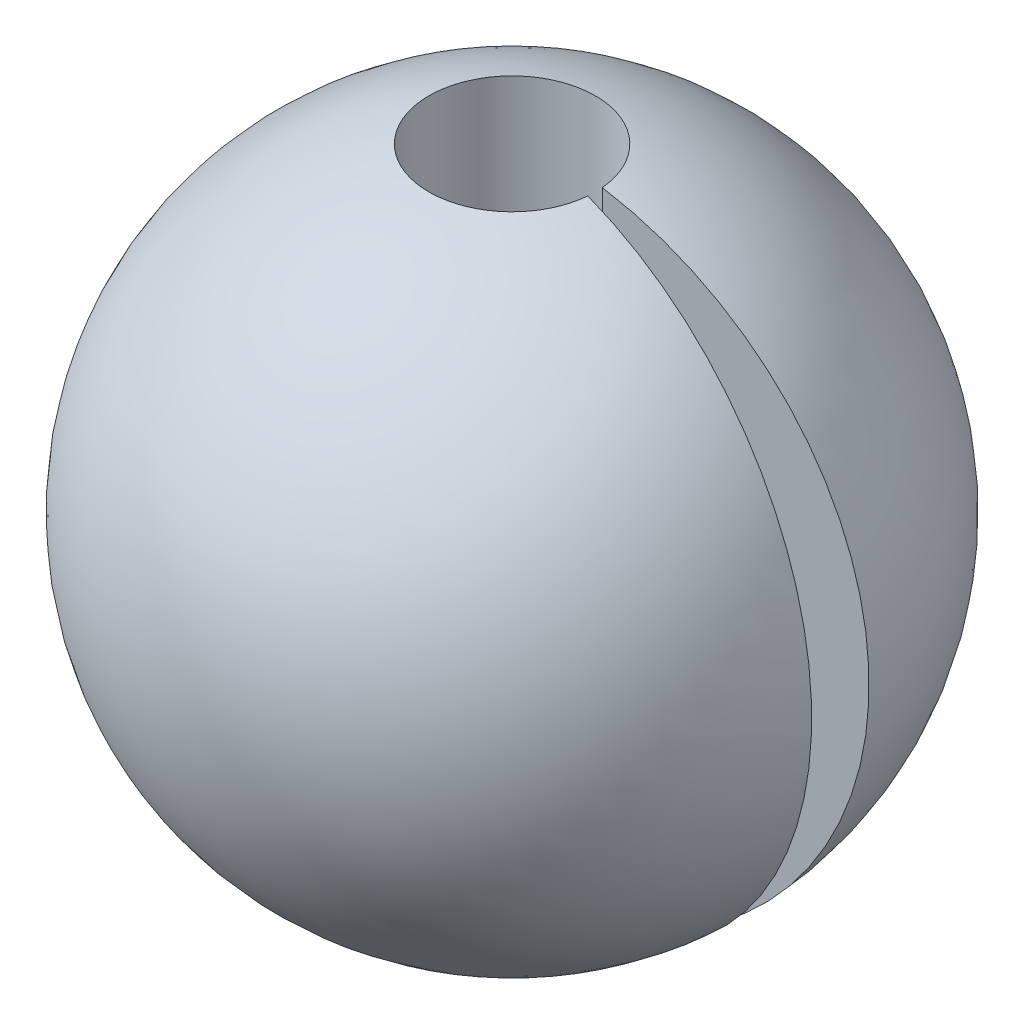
SolidWorks part; units mm, degrees
ref_plane "前视基准面" through (0, 0, 0) normal (0, 0, 1) x (1, 0, 0)
ref_plane "上视基准面" through (0, 0, 0) normal (0, 1, 0) x (1, 0, 0)
ref_plane "右视基准面" through (0, 0, 0) normal (1, 0, 0) x (0, 0, -1)
sketch "草图2" plane through (0, 0, 0) normal (1, 0, 0) x (0, 0, -1)
  line L0 (0, 0) -> (0, 203460.7422) construction
  line L2 (-240, 1071.1844) -> (-240, -767.1844)
  arc A0 (-240, 1071.1844) -> (-240, -767.1844) centre (0, 152) ccw
  dimension "D2" = 1900
revolve "旋转1" add sketch "草图2" angle 360 about L0
sketch "草图3" plane through (0, 0, 0) normal (0, 1, 0) x (1, 0, 0)
  line L0 (0, 0) -> (50000, 0) construction
  line L1 (12.7911, 1.1191) -> (49822.526, 4358.9062) construction
  line L2 (43.1507, -3.7752) -> (49852.8856, -4361.5623) construction
  line L3 (197.9704, 17.3202) -> (197.9704, -17.3202)
  line L4 (197.9704, -17.3202) -> (1119.8673, -97.9757)
  line L5 (1119.8673, -97.9757) -> (1119.8673, 97.9757)
  line L6 (1119.8673, 97.9757) -> (197.9704, 17.3202)
  dimension "D1" = 5
  dimension "D2" = 10
extrude "切除-拉伸2" cut sketch "草图3" against normal mid plane 3683
